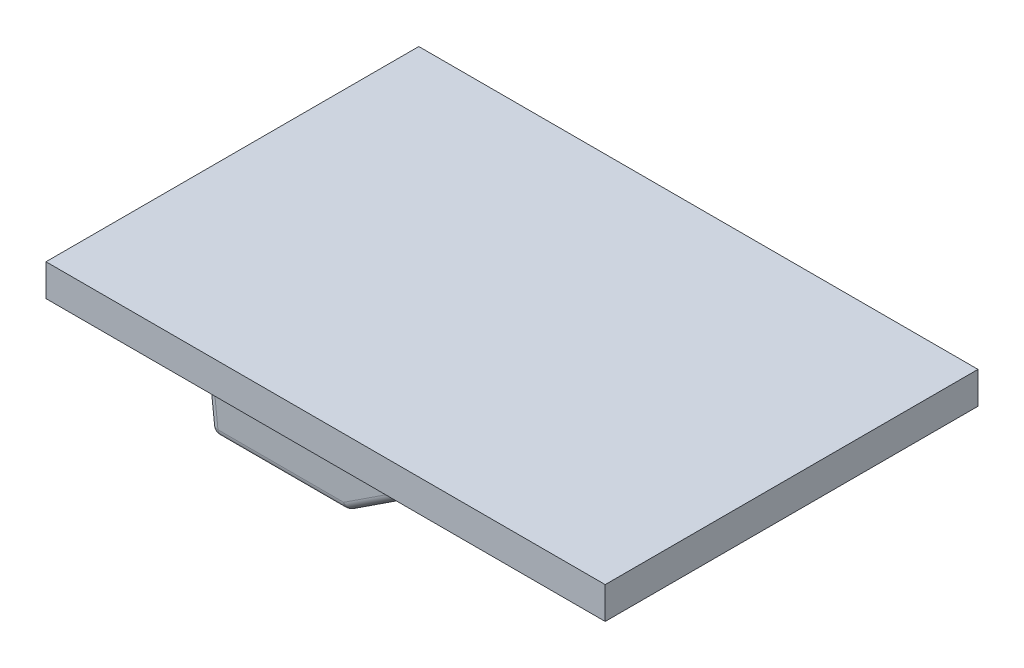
SolidWorks part; units mm, degrees
ref_plane "Front Plane" through (0, 0, 0) normal (0, 0, 1) x (1, 0, 0)
ref_plane "Top Plane" through (0, 0, 0) normal (0, 1, 0) x (1, 0, 0)
ref_plane "Right Plane" through (0, 0, 0) normal (1, 0, 0) x (0, 0, -1)
surface "Surface-Radiate1" parameters "D1"=10
surface "Surface-Knit1"
ref_plane "Plane1" through (0, 84.1874, 0) normal (0, 1, 0) x (1, 0, 0)
sketch "Sketch2" plane through (0, 84.1874, 0) normal (0, 1, 0) x (1, 0, 0)
  line L4 (-217.2569, 115.5) -> (-217.2569, -115.5)
  line L5 (-196.2569, -136.5) -> (199.7431, -136.5)
  line L6 (220.7431, -115.5) -> (220.7431, 115.5)
  line L7 (199.7431, 136.5) -> (-196.2569, 136.5)
  line L8 (-217.2569, 115.5) -> (-217.2569, -115.5)
  line L9 (-196.2569, -136.5) -> (199.7431, -136.5)
  line L10 (220.7431, -115.5) -> (220.7431, 115.5)
  line L11 (199.7431, 136.5) -> (-196.2569, 136.5)
  arc A4 (-196.2569, 136.5) -> (-217.2569, 115.5) centre (-196.2569, 115.5) ccw
  arc A5 (-217.2569, -115.5) -> (-196.2569, -136.5) centre (-196.2569, -115.5) ccw
  arc A6 (199.7431, -136.5) -> (220.7431, -115.5) centre (199.7431, -115.5) ccw
  arc A7 (220.7431, 115.5) -> (199.7431, 136.5) centre (199.7431, 115.5) ccw
  arc A8 (-196.2569, 136.5) -> (-217.2569, 115.5) centre (-196.2569, 115.5) ccw
  arc A9 (-217.2569, -115.5) -> (-196.2569, -136.5) centre (-196.2569, -115.5) ccw
  arc A10 (199.7431, -136.5) -> (220.7431, -115.5) centre (199.7431, -115.5) ccw
  arc A11 (220.7431, 115.5) -> (199.7431, 136.5) centre (199.7431, 115.5) ccw
  dimension "D1" = 0
extrude "Boss-Extrude1" add sketch "Sketch2" against normal up to surface (30 mm away)
sketch "Sketch3" plane through (0, 84.1874, 0) normal (0, 1, 0) x (1, 0, 0)
  line L1 (-262.5, -175) -> (262.5, -175)
  line L2 (-262.5, -175) -> (-262.5, 175)
  line L3 (-262.5, 175) -> (262.5, 175)
  line L4 (262.5, -175) -> (262.5, 175)
  line L5 (-262.5, -175) -> (262.5, 175) construction
  line L6 (-262.5, 175) -> (262.5, -175) construction
  point P0 (0, 0)
  dimension "D1" = 525
  dimension "D2" = 350
extrude "Boss-Extrude2" add sketch "Sketch3" against normal up to surface (30 mm away) contours L1 L4 L3 L2 M3 M10 M9 M8 M7 M6 M5 M4
